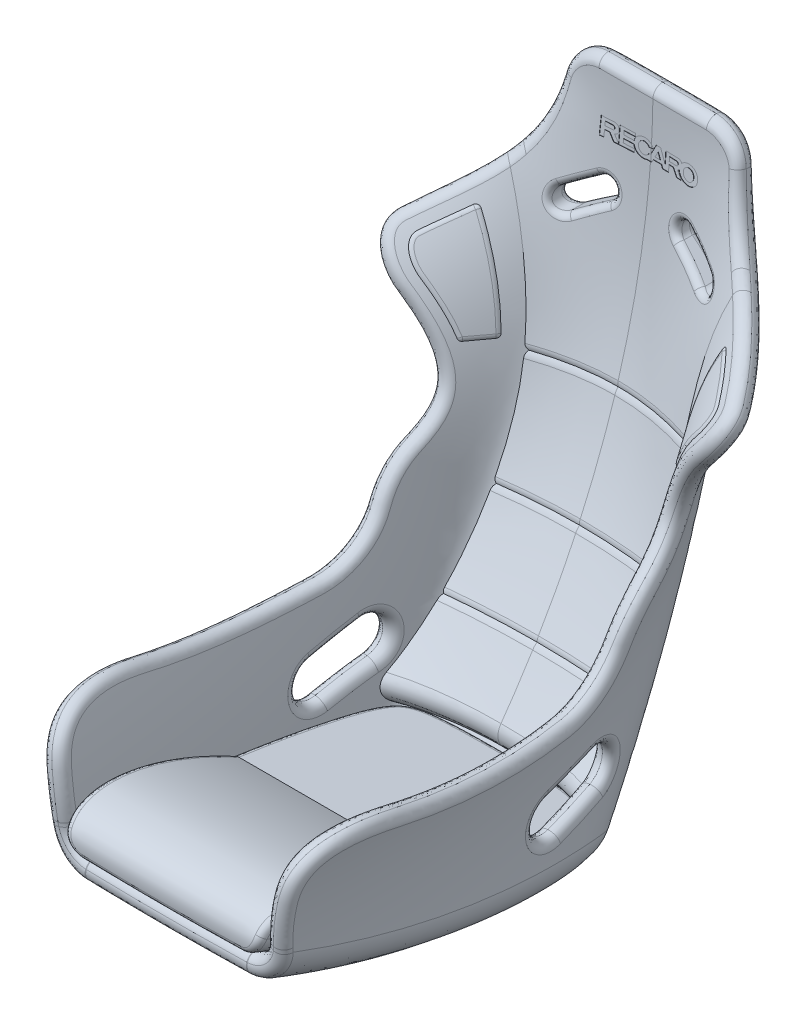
SolidWorks part; units mm, degrees
ref_plane "Plan de face" through (0, 0, 0) normal (0, 0, 1) x (1, 0, 0)
ref_plane "Plan de dessus" through (0, 0, 0) normal (0, 1, 0) x (1, 0, 0)
ref_plane "Plan de droite" through (0, 0, 0) normal (1, 0, 0) x (0, 0, -1)
imported_body "Surface-Importée3"
surface "Surface-Remplir1"
